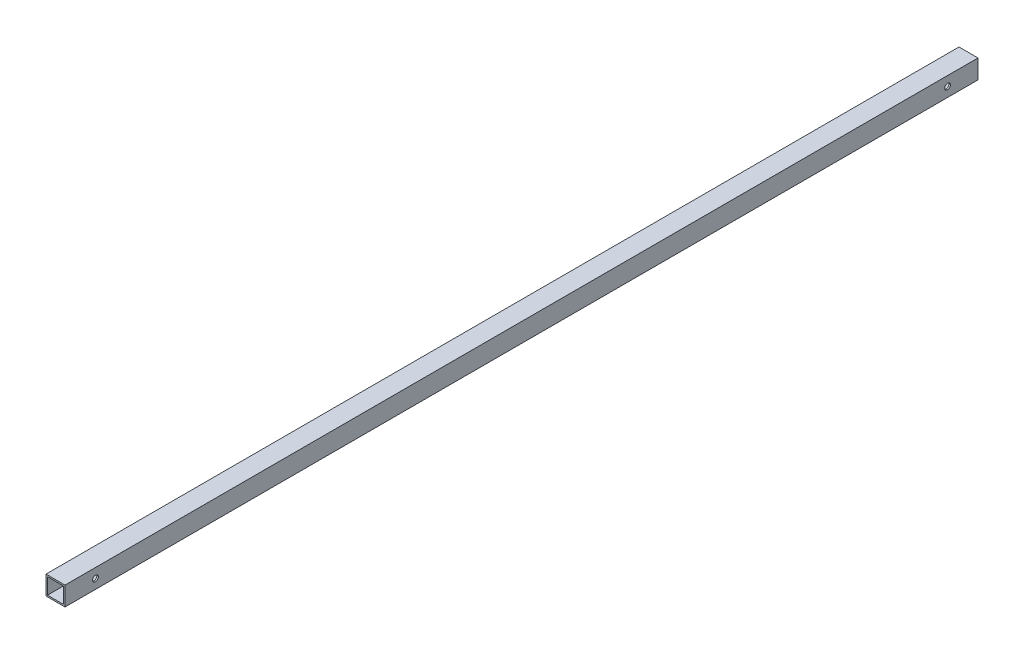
SolidWorks part; units mm, degrees
ref_plane "Front Plane" through (0, 0, 0) normal (0, 0, 1) x (1, 0, 0)
ref_plane "Top Plane" through (0, 0, 0) normal (0, 1, 0) x (1, 0, 0)
ref_plane "Right Plane" through (0, 0, 0) normal (1, 0, 0) x (0, 0, -1)
sketch "Sketch1" plane through (0, 0, 0) normal (0, 0, 1) x (1, 0, 0)
  line L0 (-13.335, 13.335) -> (13.335, 13.335)
  line L1 (-15.875, -15.875) -> (15.875, -15.875)
  line L2 (-15.875, -15.875) -> (-15.875, 15.875)
  line L3 (-15.875, 15.875) -> (15.875, 15.875)
  line L4 (15.875, -15.875) -> (15.875, 15.875)
  line L5 (-15.875, -15.875) -> (15.875, 15.875) construction
  line L6 (-15.875, 15.875) -> (15.875, -15.875) construction
  line L7 (13.335, -13.335) -> (13.335, 13.335)
  line L8 (-13.335, -13.335) -> (13.335, -13.335)
  line L9 (-13.335, -13.335) -> (-13.335, 13.335)
  point P0 (0, 0)
  dimension "D1" = 31.75
  dimension "D2" = 31.75
  dimension "D3" = 2.54
extrude "Boss-Extrude1" add sketch "Sketch1" along normal mid plane 1524
sketch "Sketch2" plane through (15.875, 0, 0) normal (1, 0, 0) x (0, 0, -1)
  line L0 (762, -15.875) -> (762, 15.875) construction
  line L1 (-762, -15.875) -> (-762, 15.875) construction
  circle A0 centre (-711.2, 0) radius 4.7625
  circle A1 centre (711.2, 0) radius 4.7625
  point P8 (-762, 0)
  point P9 (762, 0)
  dimension "D3" = 9.525
  dimension "D4" = 9.525
  dimension "D1" = 50.8
  dimension "D2" = 50.8
extrude "Cut-Extrude1" cut sketch "Sketch2" against normal through all
